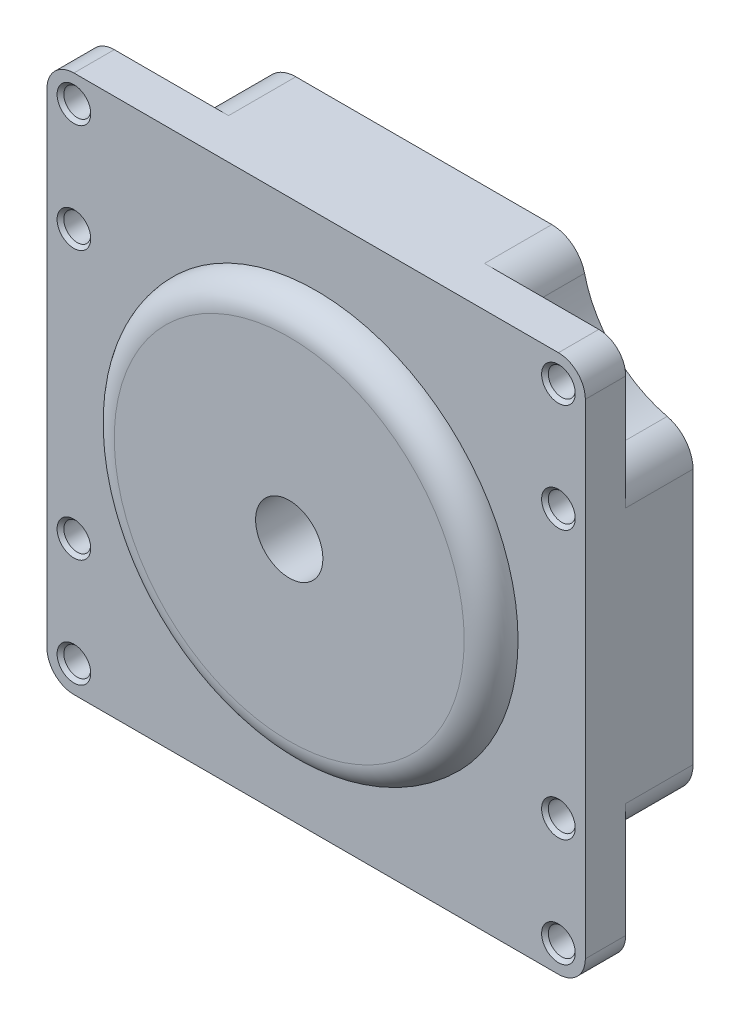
SolidWorks part; units mm, degrees
ref_plane "Front Plane" through (0, 0, 0) normal (0, 0, 1) x (1, 0, 0)
ref_plane "Top Plane" through (0, 0, 0) normal (0, 1, 0) x (1, 0, 0)
ref_plane "Right Plane" through (0, 0, 0) normal (1, 0, 0) x (0, 0, -1)
sketch "Sketch2" plane through (0, 0, 0) normal (0, 0, 1) x (1, 0, 0)
  line L0 (-20, 9.5095) -> (-20, -9.5095)
  line L1 (-9.5095, -20) -> (9.5095, -20)
  line L2 (20, -9.5095) -> (20, 9.5095)
  line L3 (9.5095, 20) -> (-9.5095, 20)
  circle A0 centre (0, 0) radius 7.5
  arc A1 (-20, -9.5095) -> (-18.0795, -11.9414) centre (-17.5, -9.5095) ccw
  arc A2 (-18.0795, -11.9414) -> (-11.9414, -18.0795) centre (-20, -20) cw
  arc A3 (-11.9414, -18.0795) -> (-9.5095, -20) centre (-9.5095, -17.5) ccw
  arc A4 (9.5095, -20) -> (11.9414, -18.0795) centre (9.5095, -17.5) ccw
  arc A5 (11.9414, -18.0795) -> (18.0795, -11.9414) centre (20, -20) cw
  arc A6 (18.0795, -11.9414) -> (20, -9.5095) centre (17.5, -9.5095) ccw
  arc A7 (20, 9.5095) -> (18.0795, 11.9414) centre (17.5, 9.5095) ccw
  arc A8 (18.0795, 11.9414) -> (11.9414, 18.0795) centre (20, 20) cw
  arc A9 (11.9414, 18.0795) -> (9.5095, 20) centre (9.5095, 17.5) ccw
  arc A10 (-9.5095, 20) -> (-11.9414, 18.0795) centre (-9.5095, 17.5) ccw
  arc A11 (-11.9414, 18.0795) -> (-18.0795, 11.9414) centre (-20, 20) cw
  arc A12 (-18.0795, 11.9414) -> (-20, 9.5095) centre (-17.5, 9.5095) ccw
  dimension "D1" = 15
extrude "Boss-Extrude1" add sketch "Sketch2" along normal blind 5
sketch "Sketch3" plane through (0, 0, 5) normal (0, 0, 1) x (1, 0, 0)
  circle A0 centre (-18, 9.9608) radius 1
  circle A1 centre (-18, -9.9608) radius 1
  circle A2 centre (-9.9608, -18) radius 1
  circle A3 centre (9.9608, -18) radius 1
  circle A4 centre (18, -9.9608) radius 1
  circle A5 centre (18, 9.9608) radius 1
  circle A6 centre (9.9608, 18) radius 1
  circle A7 centre (-9.9608, 18) radius 1
  dimension "D1" = 2
extrude "Cut-Extrude1" cut sketch "Sketch3" against normal blind 5
sketch "Sketch4" plane through (0, 0, 5) normal (0, 0, 1) x (1, 0, 0)
  line L0 (-20, 9.5095) -> (-20, -9.5095) construction
  line L1 (-20, 20) -> (20, 20)
  line L2 (-20, 20) -> (-20, -20)
  line L3 (-20, -20) -> (20, -20)
  line L4 (20, 20) -> (20, -20)
  line L5 (9.5095, 20) -> (-9.5095, 20) construction
  line L6 (20, -9.5095) -> (20, 9.5095) construction
extrude "Boss-Extrude2" add sketch "Sketch4" along normal blind 3
fillet "Fillet1" radius 2 4 edges at (-20, -20, 6.5) (-20, 20, 6.5) (20, -20, 6.5) (20, 20, 6.5)
sketch "Sketch5" plane through (0, 0, 8) normal (0, 0, 1) x (1, 0, 0)
  line L0 (-18, 18) -> (18, 18) construction
  line L1 (18, 18) -> (18, -18) construction
  line L2 (18, -18) -> (-18, -18) construction
  line L3 (-18, -18) -> (-18, 18) construction
  circle A0 centre (-18, 9.9608) radius 1
  circle A1 centre (-18, -9.9608) radius 1
  circle A2 centre (18, -9.9608) radius 1
  circle A3 centre (18, 9.9608) radius 1
  circle A4 centre (-18, 18) radius 1
  circle A5 centre (-18, -18) radius 1
  circle A6 centre (18, -18) radius 1
  circle A7 centre (18, 18) radius 1
  dimension "D1" = 2
extrude "Cut-Extrude2" cut sketch "Sketch5" against normal blind 3
sketch "Sketch6" plane through (0, 0, 8) normal (0, 0, 1) x (1, 0, 0)
  circle A0 centre (0, 0) radius 15
  dimension "D1" = 30
extrude "Boss-Extrude3" add sketch "Sketch6" along normal blind 2
fillet "Fillet2" radius 2 1 edges at (15, 0, 10)
sketch "Sketch7" plane through (0, 0, 10) normal (0, 0, 1) x (1, 0, 0)
  circle A0 centre (0, 0) radius 2.5
  dimension "D1" = 5
extrude "Cut-Extrude3" cut sketch "Sketch7" against normal blind 10
chamfer "Chamfer1" distance 0.25 angle 45 12 edges at (19, 18, 8) (19, 9.9608, 8) (19, -9.9608, 8) (19, -18, 8) (-17, -18, 8) (-17, -9.9608, 8) (-17, 9.9608, 8) (-17, 18, 8) (-17, -18, 5) (-17, 18, 5) (19, -18, 5) (19, 18, 5)
